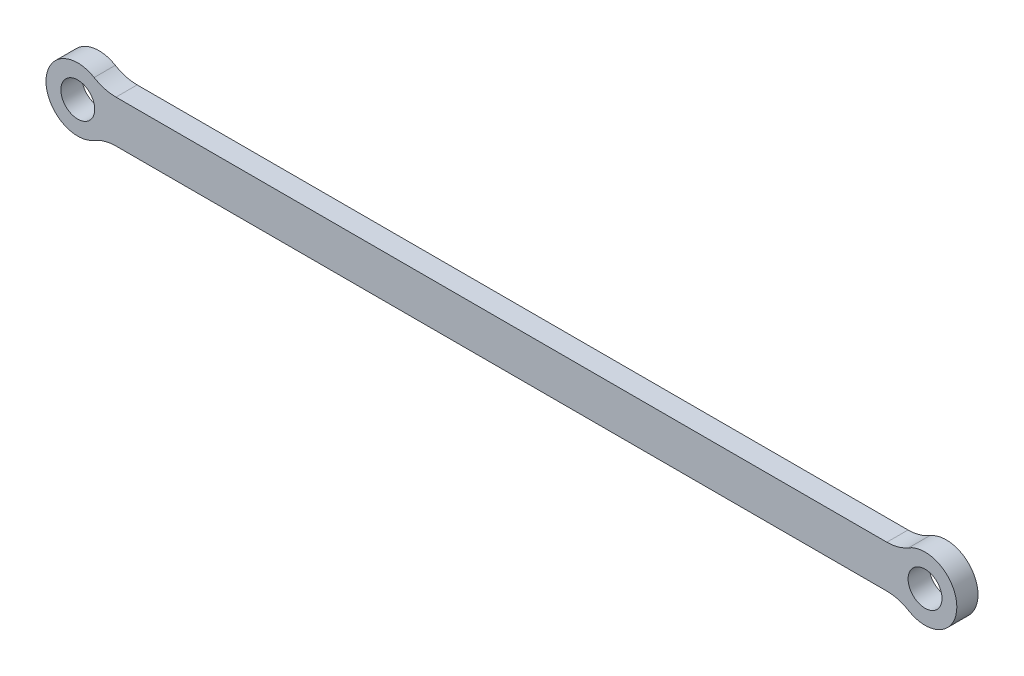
SolidWorks part; units mm, degrees
ref_plane "Alzado" through (0, 0, 0) normal (0, 0, 1) x (1, 0, 0)
ref_plane "Planta" through (0, 0, 0) normal (0, 1, 0) x (1, 0, 0)
ref_plane "Vista lateral" through (0, 0, 0) normal (1, 0, 0) x (0, 0, -1)
sketch "Croquis1" plane through (0, 0, 0) normal (0, 0, 1) x (1, 0, 0)
  line L5 (-83.1439, 347.1001) -> (98.8284, 347.1001)
  line L6 (-92.1577, 342.1001) -> (107.8423, 342.1001) construction
  line L7 (-83.1439, 337.1001) -> (98.8284, 337.1001)
  line L8 (-92.1577, 342.1001) -> (-65.0867, 322.1001) construction
  line L10 (-92.1577, 322.1001) -> (-65.0867, 322.1001) construction
  line L11 (107.8423, 342.1001) -> (107.8423, 322.1001) construction
  line L12 (107.8423, 322.1001) -> (134.9133, 322.1001) construction
  line L13 (134.9133, 322.1001) -> (107.8423, 342.1001) construction
  arc A0 (-88.2946, 348.5286) -> (-88.2946, 335.6715) centre (-92.1577, 342.1001) ccw
  circle A1 centre (-65.0867, 322.1001) radius 4 construction
  arc A2 (103.9792, 335.6715) -> (103.9792, 348.5286) centre (107.8423, 342.1001) ccw
  circle A3 centre (107.8423, 342.1001) radius 4 construction
  circle A4 centre (-92.1577, 342.1001) radius 4
  circle A5 centre (107.8423, 342.1001) radius 4
  arc A6 (-88.2946, 348.5286) -> (-83.1439, 347.1001) centre (-83.1439, 357.1001) ccw
  arc A7 (98.8284, 347.1001) -> (103.9792, 348.5286) centre (98.8284, 357.1001) ccw
  arc A8 (98.8284, 337.1001) -> (103.9792, 335.6715) centre (98.8284, 327.1001) cw
  arc A9 (-88.2946, 335.6715) -> (-83.1439, 337.1001) centre (-83.1439, 327.1001) cw
  arc A10 (-84.6577, 342.1001) -> (-88.2946, 348.5286) centre (-92.1577, 342.1001) ccw construction
  arc A11 (-88.2946, 335.6715) -> (-84.6577, 342.1001) centre (-92.1577, 342.1001) ccw construction
  arc A12 (103.9792, 348.5286) -> (100.3423, 342.1001) centre (107.8423, 342.1001) ccw construction
  arc A13 (100.3423, 342.1001) -> (103.9792, 335.6715) centre (107.8423, 342.1001) ccw construction
  circle A15 centre (107.8423, 342.1001) radius 4 construction
  circle A17 centre (107.8423, 342.1001) radius 4 construction
  point P1 (134.9133, 322.1001)
  point P25 (-65.0867, 322.1001)
  point P27 (0, 0)
  dimension "D1" = 27.0711
  dimension "D4" = 8
  dimension "D5" = 15
  dimension "D6" = 5
  dimension "D7" = 10
  dimension "D8" = 8
  dimension "D2" = 322.1001
  dimension "D3" = 65.0867
extrude "Saliente-Extruir1" add sketch "Croquis1" along normal blind 5
